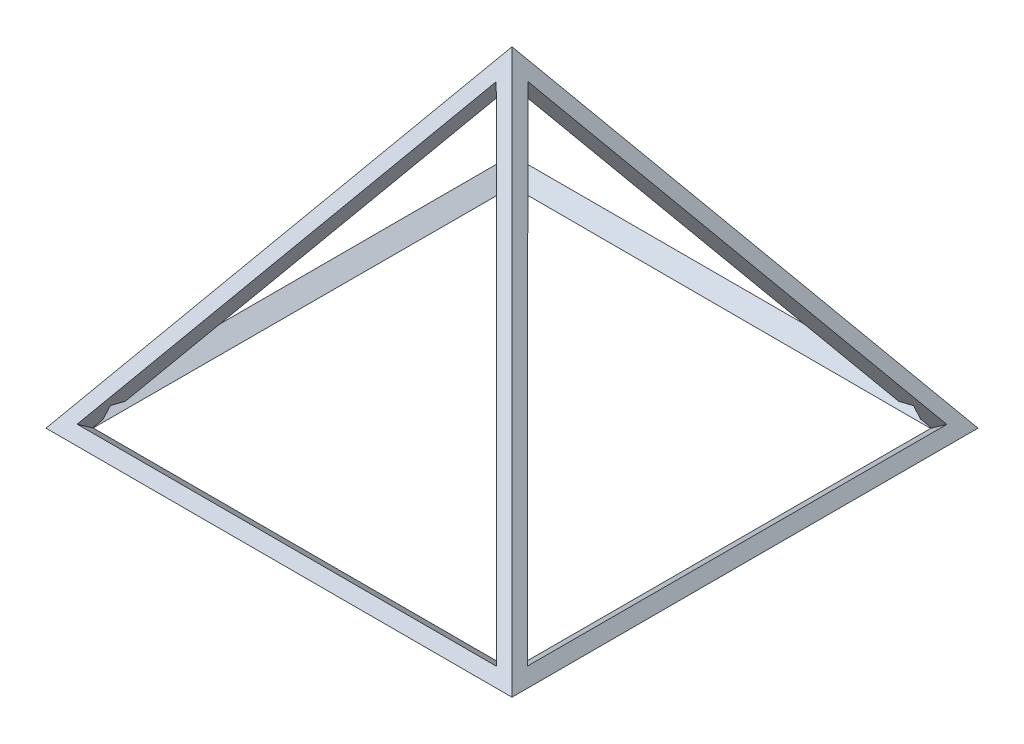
SolidWorks part; units mm, degrees
ref_plane "Front Plane" through (0, 0, 0) normal (0, 0, 1) x (1, 0, 0)
ref_plane "Top Plane" through (0, 0, 0) normal (0, 1, 0) x (1, 0, 0)
ref_plane "Right Plane" through (0, 0, 0) normal (1, 0, 0) x (0, 0, -1)
sketch "Sketch2" plane through (0, 0, 0) normal (0, 1, 0) x (1, 0, 0)
  line L1 (0, 0) -> (40, 0)
  line L2 (0, 0) -> (0, 40)
  line L3 (0, 40) -> (40, 40)
  line L4 (40, 0) -> (40, 40)
  dimension "D1" = 40
  dimension "D2" = 40
extrude "Boss-Extrude2" add sketch "Sketch2" along normal blind 40
draft "Draft5" type of draft neutral plane draft angle 35.2 faces to draft 4 parameters "D1"=35.2
sketch "Sketch3" plane through (0, 0, 0) normal (0, 0.5764, 0.8171) x (1, 0, 0)
  line L0 (20, 34.6962) -> (20, 0) construction
  line L1 (0, 0) -> (40, 0) construction
  line L2 (0, 0) -> (30, 17.3481) construction
  line L3 (20, 34.6962) -> (40, 0) construction
  line L4 (40, 0) -> (10, 17.3481) construction
  line L5 (20, 34.6962) -> (0, 0) construction
  line L7 (38, 1.1731) -> (20, 32.35)
  line L8 (20, 32.35) -> (2, 1.1731)
  line L9 (2, 1.1731) -> (38, 1.1731)
  circle A0 centre (20, 11.5654) radius 10.3923 construction
  dimension "D1" = 36
  dimension "D2" = 36
sketch "Sketch4" plane through (26.709, 18.8411, 0) normal (0.8171, 0.5764, 0) x (0, 0, -1)
  line L0 (20, 11.6389) -> (20, -23.0573) construction
  line L1 (0, -23.0573) -> (40, -23.0573) construction
  line L2 (0, -23.0573) -> (30, -5.7092) construction
  line L3 (20, 11.6389) -> (40, -23.0573) construction
  line L4 (40, -23.0573) -> (10, -5.7092) construction
  line L5 (20, 11.6389) -> (0, -23.0573) construction
  line L7 (37.9928, -21.8966) -> (20.0143, 9.2927)
  line L8 (20.0143, 9.2927) -> (1.9928, -21.8718)
  line L9 (1.9928, -21.8718) -> (37.9928, -21.8966)
  circle A0 centre (20, -11.4919) radius 10.3923 construction
  dimension "D1" = 36
sketch "Sketch5" plane through (0, 0, 0) normal (-0.8171, 0.5764, 0) x (0, 0, 1)
  line L0 (-20, 34.6962) -> (-20, 0) construction
  line L1 (-40, 0) -> (0, 0) construction
  line L2 (-40, 0) -> (-10, 17.3481) construction
  line L3 (-20, 34.6962) -> (0, 0) construction
  line L4 (0, 0) -> (-30, 17.3481) construction
  line L5 (-20, 34.6962) -> (-40, 0) construction
  line L7 (-2.0072, 1.1607) -> (-19.9857, 32.35)
  line L8 (-19.9857, 32.35) -> (-38.0072, 1.1855)
  line L9 (-38.0072, 1.1855) -> (-2.0072, 1.1607)
  circle A0 centre (-20, 11.5654) radius 10.3923 construction
  dimension "D1" = 36
sketch "Sketch6" plane through (0, 18.8411, -26.709) normal (0, 0.5764, -0.8171) x (-1, 0, 0)
  line L0 (-20, 11.6389) -> (-20, -23.0573) construction
  line L1 (-40, -23.0573) -> (0, -23.0573) construction
  line L2 (-40, -23.0573) -> (-10, -5.7092) construction
  line L3 (0, -23.0573) -> (-30, -5.7092) construction
  line L5 (-2.0072, -21.8966) -> (-19.9857, 9.2927)
  line L6 (-19.9857, 9.2927) -> (-38.0072, -21.8718)
  line L7 (-38.0072, -21.8718) -> (-2.0072, -21.8966)
  circle A0 centre (-20, -11.4919) radius 10.3923 construction
  dimension "D1" = 36
shell "Shell5" thickness 40.0478
extrude "Cut-Extrude5" cut sketch "Sketch3" against normal blind 2
extrude "Cut-Extrude6" cut sketch "Sketch4" against normal blind 2
extrude "Cut-Extrude7" cut sketch "Sketch5" against normal blind 2
extrude "Cut-Extrude9" cut sketch "Sketch6" against normal blind 2
sketch "Sketch10" plane through (0, 0, 0) normal (0, -1, 0) x (1, 0, 0)
  line L1 (2.4475, -37.5525) -> (37.8167, -37.5525)
  line L2 (2.4475, -37.5525) -> (2.4475, -2.0351)
  line L3 (2.4475, -2.0351) -> (37.8167, -2.0351)
  line L4 (37.8167, -37.5525) -> (37.8167, -2.0351)
  point P6 (2.4475, -37.5525)
sketch "Sketch11" plane through (0, 0, 0) normal (0, -1, 0) x (1, 0, 0)
  line L1 (2.4475, -37.5525) -> (37.5525, -37.5525)
  line L2 (2.4475, -37.5525) -> (2.4475, -2.4475)
  line L3 (2.4475, -2.4475) -> (37.5525, -2.4475)
  line L4 (37.5525, -37.5525) -> (37.5525, -2.4475)
extrude "Cut-Extrude10" cut sketch "Sketch11" against normal blind 2
